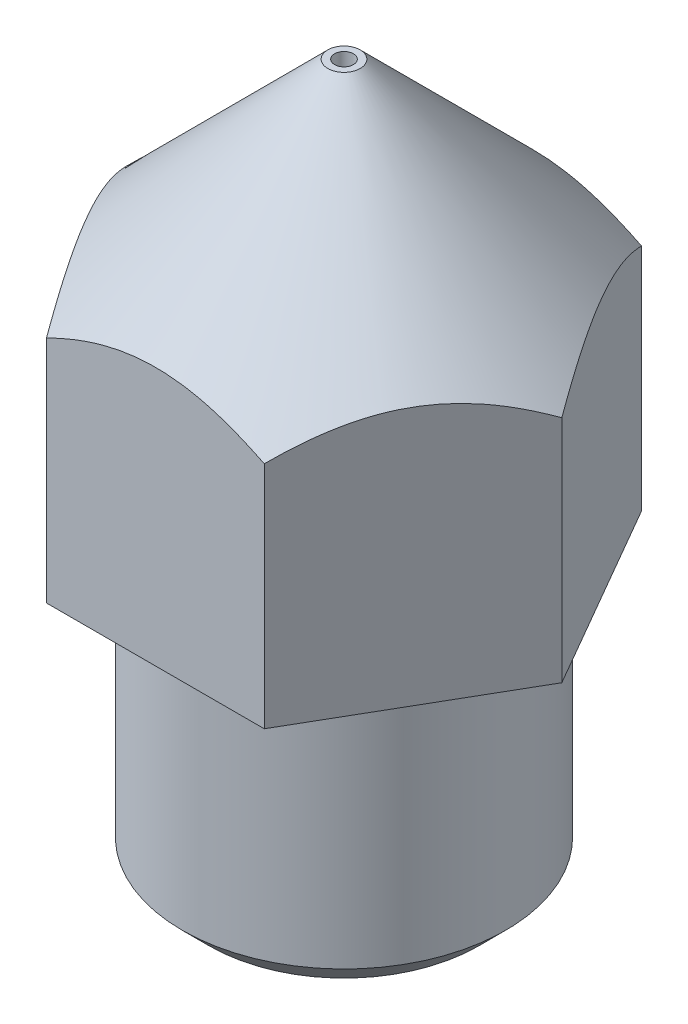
SolidWorks part; units mm, degrees
ref_plane "Front Plane" through (0, 0, 0) normal (0, 0, 1) x (1, 0, 0)
ref_plane "Top Plane" through (0, 0, 0) normal (0, 1, 0) x (1, 0, 0)
ref_plane "Right Plane" through (0, 0, 0) normal (1, 0, 0) x (0, 0, -1)
sketch "Sketch1" plane through (0, 0, 0) normal (0, 1, 0) x (1, 0, 0)
  circle A0 centre (0, 0) radius 3
  dimension "D1" = 6
extrude "Boss-Extrude1" add sketch "Sketch1" along normal blind 5
sketch "Sketch2" plane through (0, 5, 0) normal (0, 1, 0) x (1, 0, 0)
  line L1 (2.0207, 3.5) -> (-2.0207, 3.5)
  line L2 (-2.0207, 3.5) -> (-4.0415, 0)
  line L3 (-4.0415, 0) -> (-2.0207, -3.5)
  line L4 (-2.0207, -3.5) -> (2.0207, -3.5)
  line L5 (2.0207, -3.5) -> (4.0415, 0)
  line L6 (4.0415, 0) -> (2.0207, 3.5)
  circle A0 centre (0, 0) radius 3.5 construction
  dimension "D1" = 7
extrude "Boss-Extrude2" add sketch "Sketch2" along normal blind 8
sketch "Sketch4" plane through (0, 0, 0) normal (0, 0, 1) x (1, 0, 0)
  line L0 (0, 0) -> (0, 13) construction
  line L1 (-2.0207, 13) -> (2.0207, 13) construction
  line L2 (0, 13) -> (0.3, 13) construction
  line L3 (0.3, 13) -> (4.0415, 9.2585)
  line L4 (4.0415, 13) -> (4.0415, 5) construction
  line L5 (0.3, 13) -> (4.0415, 13)
  line L6 (4.0415, 13) -> (4.0415, 9.2585)
  dimension "D2" = 0.3
revolve "Cut-Revolve2" cut sketch "Sketch4" angle 360 about L0
sketch "Sketch5" plane through (0, 0, 0) normal (0, 0, 1) x (1, 0, 0)
  line L0 (0, 13) -> (0, 0) construction
  line L1 (0.3, 13) -> (-0.3, 13) construction
  line L2 (0, 0) -> (2.5, 0) construction
  line L3 (-3, 0) -> (3, 0) construction
  line L4 (2.5, 0) -> (3, 0.5)
  line L5 (3, 0) -> (3, 5) construction
  line L6 (3, 0.5) -> (3, 0)
  line L7 (3, 0) -> (2.5, 0)
  dimension "D1" = 0.5
  dimension "D2" = 0.5
revolve "Cut-Revolve3" cut sketch "Sketch5" angle 360 about L0
sketch "Sketch6" plane through (0, 0, 0) normal (0, 0, 1) x (1, 0, 0)
  line L0 (0.175, 13) -> (0, 13)
  line L1 (0.3, 13) -> (-0.3, 13) construction
  line L2 (0, 13) -> (0, 0)
  line L3 (0.175, 13) -> (0.175, 12.5)
  line L4 (0.175, 12.5) -> (1.25, 10.638)
  line L5 (1.25, 10.638) -> (1.25, 0)
  line L6 (-2.5, 0) -> (2.5, 0) construction
  line L7 (1.25, 0) -> (0, 0)
  dimension "D1" = 0.175
  dimension "D2" = 0.5
  dimension "D3" = 150
  dimension "D4" = 1.25
revolve "Cut-Revolve4" cut sketch "Sketch6" angle 360 about L2
